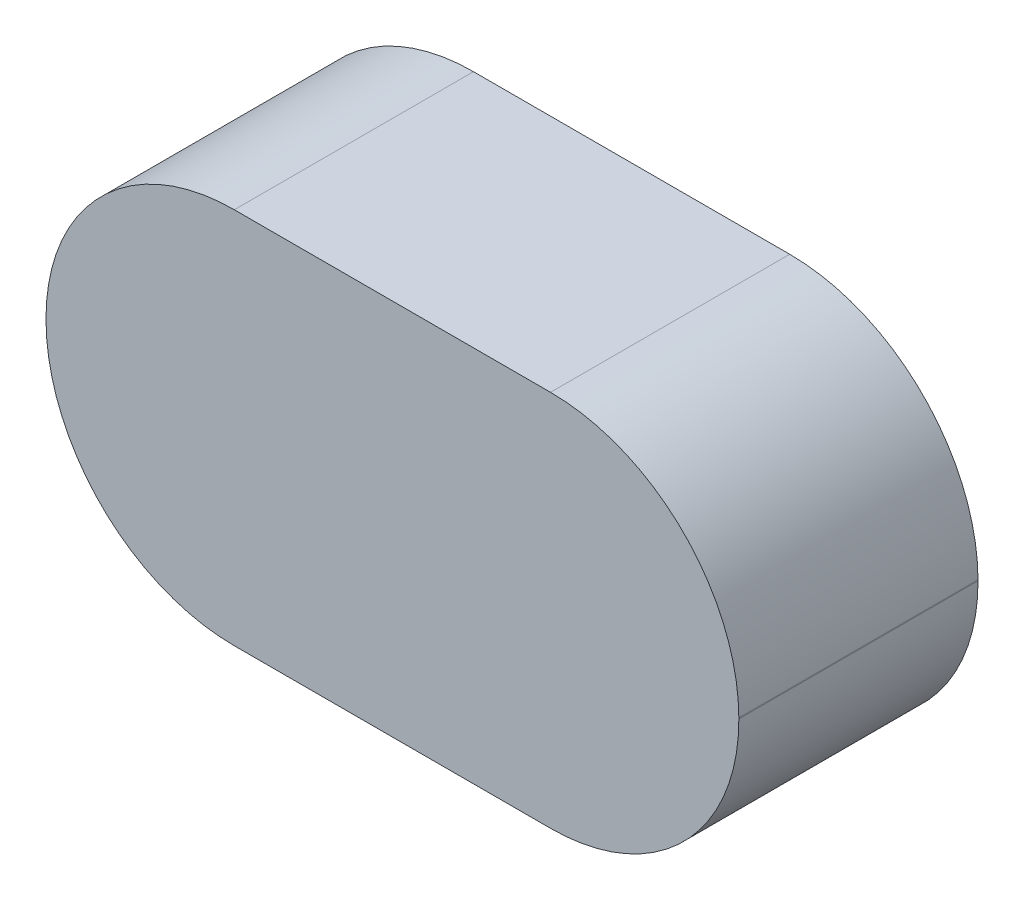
SolidWorks part; units mm, degrees
ref_plane "Front Plane" through (0, 0, 0) normal (0, 0, 1) x (1, 0, 0)
ref_plane "Top Plane" through (0, 0, 0) normal (0, 1, 0) x (1, 0, 0)
ref_plane "Right Plane" through (0, 0, 0) normal (1, 0, 0) x (0, 0, -1)
sketch "Component_Outline" plane through (0, 0, 0) normal (0, 0, 1) x (1, 0, 0)
  line L0 (-3.5, 1.71) -> (3.485, 1.71)
  line L1 (3.485, 1.71) -> (3.4959, -2.1)
  line L2 (3.4959, -2.1) -> (-3.5, -2.1)
  line L3 (-3.5, -2.1) -> (-3.5, 1.71)
  dimension "D1" = 6.985
  dimension "D2" = 3.81
  dimension "D3" = 3.81
extrude "Boss-Extrude1" add sketch "Component_Outline" along normal blind 2.413
fillet "Fillet1" radius 1.9 4 edges at (3.4959, -2.1, 1.2065) (3.485, 1.71, 1.2065) (-3.5, 1.71, 1.2065) (-3.5, -2.1, 1.2065)
